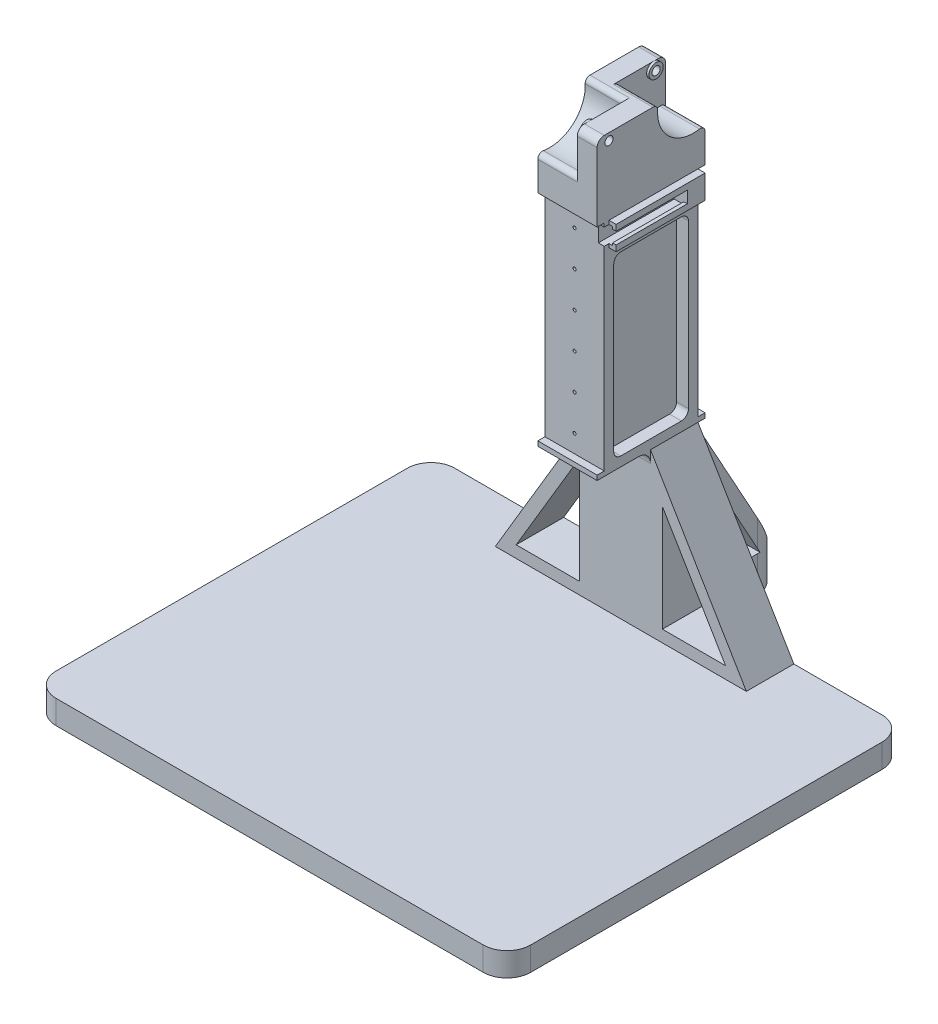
SolidWorks part; units mm, degrees
ref_plane "Front" through (0, 0, 0) normal (0, 0, 1) x (1, 0, 0)
ref_plane "Top" through (0, 0, 0) normal (0, 1, 0) x (1, 0, 0)
ref_plane "Right" through (0, 0, 0) normal (1, 0, 0) x (0, 0, -1)
sketch "Sketch1" plane through (0, 0, 0) normal (1, 0, 0) x (0, 0, -1)
  line L0 (0, 0) -> (0, -10)
  line L1 (0, -10) -> (67.49, -10)
  line L2 (67.49, -10) -> (67.49, 160.5)
  line L3 (67.49, 160.5) -> (27.987, 160.5)
  line L4 (27.987, 160.5) -> (27.987, 70)
  line L5 (27.987, 70) -> (47.49, 70)
  line L6 (47.49, 70) -> (47.49, 0)
  line L7 (47.49, 0) -> (0, 0)
  line L8 (50, 0) -> (-50, 0) construction
  line L9 (0, 50) -> (0, -50) construction
  dimension "D1" = 10
  dimension "D3" = 27.987
  dimension "D4" = 70
  dimension "D5" = 90.5
  dimension "D6" = 67.49
  dimension "D7" = 20
extrude "Boss-Extrude1" add sketch "Sketch1" along normal mid plane 25
hole_wizard "#55 (0.052) Diameter Hole1" positions "Sketch2" profile "Sketch3" hole size "#55" standard "ANSI Inch"
sketch "Sketch2" plane through (0, 0, -27.987) normal (0, 0, 1) x (1, 0, 0)
  line L0 (0, 77.5) -> (0, 92.5) construction
  line L1 (0, 92.5) -> (0, 107.5) construction
  line L2 (0, 107.5) -> (0, 122.5) construction
  line L4 (0, -50) -> (0, 50) construction
  line L5 (12.5, 70) -> (-12.5, 70) construction
  point P0 (0, 77.5)
  point P2 (0, 92.5)
  point P4 (0, 107.5)
  point P6 (0, 122.5)
  point P20 (0, 137.5)
  point P21 (0, 152.5)
  dimension "D1" = 15
  dimension "D2" = 7.5
  dimension "D3" = 15
  dimension "D4" = 15
sketch "Sketch3" plane through (0, 77.5, -27.987) normal (1, 0, 0) x (0, -1, 0)
  line L0 (0, 0) -> (0, 10.3968)
  line L1 (0, 10.3968) -> (0.6604, 10)
  line L2 (0.6604, 10) -> (0.6604, 0)
  line L5 (0.6604, 0) -> (0, 0)
  line L10 (0, 10.3968) -> (-0.6604, 10) construction
  line L11 (0, -6.35) -> (0, 107.95) construction
  dimension "Hole Dia." = 1.3208
  dimension "Hole Depth" = 10
  dimension "Drill Angle" = 118
sketch "Sketch4" plane through (0, 0, 0) normal (0, 1, 0) x (1, 0, 0)
  line L1 (-90, 67.4905) -> (90, 67.4905)
  line L2 (-100, 57.4905) -> (-100, -90.5095)
  line L3 (-90, -100.5095) -> (90, -100.5095)
  line L4 (100, 57.4905) -> (100, -90.5095)
  line L5 (0, 0) -> (0, 131.3458) construction
  arc A0 (-100, -90.5095) -> (-90, -100.5095) centre (-90, -90.5095) ccw
  arc A1 (90, -100.5095) -> (100, -90.5095) centre (90, -90.5095) ccw
  arc A2 (90, 67.4905) -> (100, 57.4905) centre (90, 57.4905) cw
  arc A3 (-90, 67.4905) -> (-100, 57.4905) centre (-90, 57.4905) ccw
  point P0 (0, 67.4905)
  point P11 (100, -100.5095)
  point P14 (100, 67.4905)
  point P17 (-100, 67.4905)
  dimension "D1" = 200
  dimension "D4" = 10
  dimension "D2" = 168
extrude "Boss-Extrude4" add sketch "Sketch4" against normal up to surface (10 mm away)
sketch "Sketch5" plane through (0, 70, 0) normal (0, -1, 0) x (1, 0, 0)
  line L0 (0, -50) -> (0, 50) construction
  line L1 (-12.5, -47.49) -> (12.5, -47.49)
  line L2 (-12.5, -47.49) -> (-12.5, -24.987)
  line L3 (-12.5, -24.987) -> (12.5, -24.987)
  line L4 (12.5, -47.49) -> (12.5, -24.987)
  line L5 (-12.5, -47.49) -> (12.5, -24.987) construction
  line L6 (-12.5, -24.987) -> (12.5, -47.49) construction
  line L7 (12.5, -27.987) -> (12.5, -47.49) construction
  line L8 (12.5, -47.49) -> (-12.5, -47.49) construction
  line L9 (12.5, -27.987) -> (-12.5, -27.987) construction
  point P0 (0, -36.2385)
  dimension "D1" = 3
extrude "Boss-Extrude5" add sketch "Sketch5" along normal blind 2
sketch "Sketch6" plane through (0, 160.5, 0) normal (0, 1, 0) x (1, 0, 0)
  line L0 (12.5, 67.49) -> (-12.5, 67.49) construction
  line L4 (12.5, 47.49) -> (-12.5, 47.49)
  line L5 (12.5, 24.987) -> (12.5, 47.49)
  line L6 (-12.5, 24.987) -> (12.5, 24.987)
  line L7 (-12.5, 47.49) -> (-12.5, 24.987)
  line L8 (12.5, 67.49) -> (-12.5, 67.49)
  line L9 (12.5, 24.987) -> (12.5, 67.49)
  line L10 (-12.5, 24.987) -> (12.5, 24.987)
  line L11 (-12.5, 67.49) -> (-12.5, 24.987)
  dimension "D1" = 0
extrude "Boss-Extrude6" add sketch "Sketch6" along normal blind 2
fillet "Fillet1" radius 5 1 edges at (0, 68, -47.49)
sketch "Sketch7" plane through (12.5, 0, 0) normal (1, 0, 0) x (0, 0, -1)
  line L0 (67.49, 0) -> (67.49, 162.5) construction
  line L1 (27.987, 160.5) -> (67.49, 160.5)
  line L2 (27.987, 160.5) -> (27.987, 150.5)
  line L3 (27.987, 150.5) -> (67.49, 150.5)
  line L4 (67.49, 160.5) -> (67.49, 150.5)
  line L5 (27.987, 160.5) -> (27.987, 70) construction
  line L6 (24.987, 162.5) -> (67.49, 162.5) construction
  dimension "D1" = 2
  dimension "D2" = 10
extrude "Boss-Extrude7" add sketch "Sketch7" along normal blind 3
sketch "Sketch8" plane through (0, 0, -27.987) normal (0, 0, 1) x (1, 0, 0)
  line L0 (15.5, 158) -> (14, 158)
  line L1 (14, 158) -> (14, 159)
  line L5 (14, 152) -> (14, 153)
  line L6 (14, 153) -> (15.5, 153)
  line L7 (15.5, 153) -> (15.5, 158)
  line L8 (12.5, 155.5) -> (15.5, 155.5) construction
  line L9 (15.5, 160.5) -> (15.5, 150.5) construction
  line L12 (14, 158) -> (14, 153) construction
  line L13 (14, 159) -> (10, 159)
  line L14 (10, 159) -> (10, 152)
  line L15 (10, 152) -> (14, 152)
  point P14 (15.5, 155.5)
  dimension "D1" = 1.5
  dimension "D2" = 4
  dimension "D3" = 5
sketch "Sketch9" plane through (0, 0, -67.49) normal (0, 0, -1) x (-1, 0, 0)
  line L0 (12.5, 0) -> (12.5, 162.5) construction
  line L1 (-12.5, 162.5) -> (12.5, 162.5)
  line L2 (-12.5, 162.5) -> (-12.5, 160.5)
  line L3 (-12.5, 160.5) -> (12.5, 160.5)
  line L4 (12.5, 162.5) -> (12.5, 160.5)
  line L5 (-15.5, 160.5) -> (-12.5, 160.5) construction
extrude "Boss-Extrude8" add sketch "Sketch9" along normal blind 3
sketch "Sketch10" plane through (0, 0, -67.49) normal (0, 0, -1) x (-1, 0, 0)
  line L0 (-12.5, 0) -> (-12.5, 150.5) construction
  line L1 (-12.5, 70) -> (12.5, 70)
  line L2 (-12.5, 70) -> (-12.5, 68)
  line L3 (-12.5, 68) -> (12.5, 68)
  line L4 (12.5, 70) -> (12.5, 68)
  line L5 (12.5, 0) -> (12.5, 160.5) construction
  line L7 (-12.5, 160.5) -> (12.5, 160.5) construction
  dimension "D1" = 2
  dimension "D2" = 90.5
extrude "Boss-Extrude9" add sketch "Sketch10" along normal blind 3
sketch "Sketch11" plane through (0, 0, -67.49) normal (0, 0, -1) x (-1, 0, 0)
  line L0 (12.5, 70) -> (-12.5, 70) construction
  point P0 (0, 77.5)
  point P1 (0, 92.5)
  point P2 (0, 107.5)
  point P3 (0, 122.5)
  point P4 (0, 137.5)
  point P5 (0, 152.5)
  dimension "D1" = 7.5
  dimension "D2" = 15
  dimension "D3" = 15
  dimension "D4" = 15
  dimension "D5" = 15
  dimension "D6" = 15
hole_wizard "#55 (0.052) Diameter Hole2" positions "Sketch12" profile "Sketch13" hole size "#55" standard "ANSI Inch"
sketch "Sketch12" plane through (0, 0, -67.49) normal (0, 0, -1) x (-1, 0, 0)
  point P0 (0, 77.5)
  point P3 (0, 92.5)
  point P6 (0, 107.5)
  point P9 (0, 122.5)
  point P12 (0, 137.5)
  point P15 (0, 152.5)
sketch "Sketch13" plane through (0, 77.5, -67.49) normal (1, 0, 0) x (0, 1, 0)
  line L0 (0, 0) -> (0, 10.3968)
  line L1 (0, 10.3968) -> (0.6604, 10)
  line L2 (0.6604, 10) -> (0.6604, 0)
  line L5 (0.6604, 0) -> (0, 0)
  line L10 (0, 10.3968) -> (-0.6604, 10) construction
  line L11 (0, -6.35) -> (0, 107.95) construction
  dimension "Hole Dia." = 1.3208
  dimension "Hole Depth" = 10
  dimension "Drill Angle" = 118
sketch "Sketch19" plane through (0, 0, -67.49) normal (0, 0, -1) x (-1, 0, 0)
  line L0 (-12.5, 68) -> (-52.9003, 0)
  line L1 (-52.9003, 0) -> (-12.5, 0)
  line L2 (-12.5, 0) -> (12.5, 0) construction
  line L3 (-12.5, 0) -> (-12.5, 68)
  line L4 (0, 68) -> (0, 0) construction
  line L5 (52.9003, 0) -> (12.5, 0)
  line L6 (12.5, 68) -> (52.9003, 0)
  line L7 (12.5, 0) -> (12.5, 68)
extrude "Extrude-Thin1" add sketch "Sketch19" against normal blind 20 thin
sketch "Sketch20" plane through (0, 0, -67.49) normal (0, 0, -1) x (-1, 0, 0)
  line L0 (-12.5, 68) -> (12.5, 68) construction
  line L1 (-10, 68) -> (10, 68)
  line L2 (-10, 68) -> (-10, 0)
  line L4 (10, 68) -> (10, 0)
  line L6 (-10, 0) -> (10, 0)
  line L7 (-52.9003, 0) -> (52.9003, 0) construction
  dimension "D1" = 20
  dimension "D2" = 2.5
extrude "Boss-Extrude11" add sketch "Sketch20" along normal blind 43
sketch "Sketch22" plane through (10, 0, 0) normal (1, 0, 0) x (0, 0, -1)
  line L1 (67.49, 68) -> (104.9772, 0)
  line L4 (104.9772, 68) -> (67.49, 68)
  line L6 (110.49, 0) -> (67.4905, 0) construction
  line L7 (104.9772, 68) -> (110.49, 68)
  line L8 (110.49, 68) -> (110.49, 0) construction
  line L9 (110.49, 68) -> (70.49, 68) construction
  line L10 (110.49, 68) -> (110.49, 0)
  line L11 (110.49, 0) -> (104.9772, 0)
extrude "Cut-Extrude4" cut sketch "Sketch22" against normal blind 43
sketch "Sketch24" plane through (10, 0, 0) normal (1, 0, 0) x (0, 0, -1)
  line L0 (72.49, 47.9007) -> (72.49, 0)
  line L2 (98.8968, 0) -> (72.49, 47.9007)
  line L3 (67.49, 68) -> (104.9772, 0) construction
  line L4 (67.49, 68) -> (67.49, 0) construction
  line L6 (72.49, 0) -> (98.8968, 0)
  line L7 (104.9772, 0) -> (67.4905, 0) construction
  dimension "D1" = 0
  dimension "D2" = 5
extrude "Cut-Extrude5" cut sketch "Sketch24" against normal blind 43
sketch "Sketch12" plane through (0, 0, -67.4905) normal (0, 0, -1) x (-1, 0, 0)
  line L0 (90, -10) -> (-90, -10) construction
  line L1 (-10, 0) -> (10, 0)
  line L2 (-10, 0) -> (-10, -10)
  line L3 (-10, -10) -> (10, -10)
  line L4 (10, 0) -> (10, -10)
  line L5 (10, 0) -> (10, 68) construction
extrude "Boss-Extrude13" add sketch "Sketch12" along normal blind 37.5
sketch "Sketch13" plane through (0, 0, -72.49) normal (0, 0, -1) x (-1, 0, 0)
  line L0 (10, 47.9007) -> (10, 0) construction
  line L1 (-10, 0) -> (10, 0)
  line L2 (-10, 0) -> (-10, 5)
  line L3 (-10, 5) -> (10, 5)
  line L4 (10, 0) -> (10, 5)
  line L5 (-44.1138, 5) -> (-17.5, 5) construction
extrude "Boss-Extrude14" add sketch "Sketch13" along normal up to next
fillet "Fillet4" radius 10 2 edges at (10, -5, -104.9905) (-10, -5, -104.9905)
sketch "Sketch28" plane through (0, 162.5, 0) normal (0, 1, 0) x (1, 0, 0)
  line L0 (12.5, 24.987) -> (12.5, 70.49) construction
  line L2 (12.5, 27.987) -> (12.5, 67.49)
  line L4 (-12.5, 27.987) -> (-12.5, 67.49)
  line L5 (15.5, 27.987) -> (12.5, 27.987) construction
  line L6 (-52.9003, 67.49) -> (-12.5, 67.49) construction
  line L7 (-12.5, 70.49) -> (-12.5, 24.987) construction
  line L8 (-12.5, 24.987) -> (12.5, 24.987)
  line L9 (12.5, 24.987) -> (12.5, 27.987)
  line L10 (-12.5, 24.987) -> (-12.5, 27.987)
  line L11 (-12.5, 67.49) -> (-12.5, 70.49)
  line L12 (-12.5, 70.49) -> (12.5, 70.49)
  line L13 (12.5, 70.49) -> (12.5, 67.49)
extrude "Boss-Extrude15" add sketch "Sketch28" along normal blind 30
sketch "Sketch36" plane through (12.5, 0, 0) normal (1, 0, 0) x (0, 0, -1)
  line L0 (24.987, 192.5) -> (70.49, 192.5) construction
  line L1 (70.49, 192.5) -> (70.49, 160.5) construction
  circle A0 centre (65.49, 189.5) radius 15
  dimension "D1" = 30
  dimension "D2" = 3
  dimension "D3" = 5
extrude "Cut-Extrude8" cut sketch "Sketch36" against normal blind 16.65
sketch "Sketch37" plane through (-12.5, 0, 0) normal (-1, 0, 0) x (0, 0, 1)
  line L0 (-24.987, 192.5) -> (-24.987, 160.5) construction
  line L1 (-70.49, 192.5) -> (-24.987, 192.5) construction
  circle A0 centre (-29.987, 189.5) radius 15
  dimension "D1" = 30
  dimension "D2" = 5
  dimension "D3" = 3
extrude "Cut-Extrude9" cut sketch "Sketch37" against normal blind 16.65
sketch "Sketch38" plane through (4.15, 0, 0) normal (-1, 0, 0) x (0, 0, 1)
  line L1 (-44.6839, 192.5) -> (-24.987, 192.5) construction
  line L2 (-24.987, 175.3579) -> (-24.987, 192.5) construction
  point P0 (-29.987, 189.5)
  dimension "D1" = 5
  dimension "D2" = 3
hole_wizard "#8-36 Tapped Hole1" positions "Sketch39" profile "Sketch40" tap size "#8-36" standard "ANSI Inch"
sketch "Sketch39" plane through (4.15, 0, 0) normal (-1, 0, 0) x (0, 0, 1)
  point P0 (-29.987, 189.5)
sketch "Sketch40" plane through (4.15, 189.5, -29.987) normal (0, 1, 0) x (0, 0, 1)
  line L0 (0, 0) -> (0, 8.35)
  line L1 (0, 8.35) -> (1.7272, 8.35)
  line L2 (1.7272, 8.35) -> (1.7272, 0)
  line L5 (1.7272, 0) -> (0, 0)
  line L11 (0, -6.35) -> (0, 107.95) construction
  dimension "Thru Tap Drill Dia." = 3.4544
  dimension "Thru Tap Drill Depth" = 8.35
sketch "Sketch41" plane through (-4.15, 0, 0) normal (1, 0, 0) x (0, 0, -1)
  line L0 (50.7931, 192.5) -> (70.49, 192.5) construction
  line L2 (70.49, 192.5) -> (70.49, 175.3579) construction
  point P0 (65.49, 189.5)
  dimension "D1" = 3
  dimension "D2" = 5
hole_wizard "#8-32 Tapped Hole1" positions "Sketch44" profile "Sketch43" tap size "#8-32" standard "ANSI Inch"
sketch "Sketch44" plane through (-4.15, 0, 0) normal (1, 0, 0) x (0, 0, -1)
  point P0 (65.49, 189.5)
sketch "Sketch43" plane through (-4.15, 189.5, -65.49) normal (0, 1, 0) x (0, 0, -1)
  line L0 (0, 0) -> (0, 8.35)
  line L1 (0, 8.35) -> (1.7272, 8.35)
  line L2 (1.7272, 8.35) -> (1.7272, 0)
  line L5 (1.7272, 0) -> (0, 0)
  line L11 (0, -6.35) -> (0, 107.95) construction
  dimension "Thru Tap Drill Dia." = 3.4544
  dimension "Thru Tap Drill Depth" = 8.35
fillet "Fillet6" radius 3 2 edges at (-8.325, 192.5, -70.49) (8.325, 192.5, -24.987)
extrude "Cut-Extrude10" cut sketch "Sketch8" against normal blind 32
sketch "Sketch45" plane through (0, 160.5, 0) normal (0, 1, 0) x (1, 0, 0)
  line L0 (15.5, 67.49) -> (15.5, 27.987) construction
  line L1 (12.5, 27.987) -> (15.5, 27.987)
  line L2 (12.5, 27.987) -> (12.5, 29.987)
  line L3 (12.5, 29.987) -> (15.5, 29.987)
  line L4 (15.5, 27.987) -> (15.5, 29.987)
  dimension "D1" = 2
extrude "Cut-Extrude11" cut sketch "Sketch45" against normal up to surface (10 mm away)
sketch "Sketch46" plane through (-4.15, 0, 0) normal (1, 0, 0) x (0, 0, -1)
  circle A0 centre (65.49, 189.5) radius 3
  circle A1 centre (65.49, 189.5) radius 1.7272
  dimension "D1" = 6
fillet "Fillet10" radius 2 4 edges at (-4.175, 192.5, -44.6839) (-4.175, 175.3579, -24.987) (4.175, 192.5, -50.7931) (4.175, 175.3579, -70.49)
sketch "Sketch47" plane through (4.15, 0, 0) normal (-1, 0, 0) x (0, 0, 1)
  circle A0 centre (-29.987, 189.5) radius 3
  circle A1 centre (-29.987, 189.5) radius 1.7272
  dimension "D1" = 6
extrude "Boss-Extrude18" add sketch "Sketch47" along normal blind 1
sketch "Sketch48" plane through (-4.15, 0, 0) normal (1, 0, 0) x (0, 0, -1)
  circle A0 centre (65.49, 189.5) radius 1.7272
  circle A1 centre (65.49, 189.5) radius 2.38
  dimension "D1" = 4.76
extrude "Boss-Extrude19" add sketch "Sketch48" along normal blind 1
extrude "Boss-Extrude17" add sketch "Sketch46" along normal blind 1
sketch "Sketch49" plane through (12.5, 0, 0) normal (1, 0, 0) x (0, 0, -1)
  line L0 (29.987, 150.5) -> (67.49, 150.5) construction
  line L1 (31.987, 146.5) -> (63.49, 146.5)
  line L2 (31.987, 146.5) -> (31.987, 72)
  line L3 (31.987, 72) -> (63.49, 72)
  line L4 (63.49, 146.5) -> (63.49, 72)
  line L5 (47.49, 68) -> (67.49, 68) construction
  line L6 (67.49, 70) -> (67.49, 150.5) construction
  line L7 (27.987, 152) -> (27.987, 70) construction
  dimension "D1" = 4
  dimension "D2" = 4
  dimension "D3" = 4
  dimension "D4" = 4
extrude "Cut-Extrude12" cut sketch "Sketch49" against normal blind 5
mirror "Mirror1" about plane through (0, 0, 0) normal (1, 0, 0) of "Cut-Extrude12"
fillet "Fillet11" radius 3 8 edges at (-10, 146.5, -31.987) (-10, 146.5, -63.49) (-10, 72, -31.987) (-10, 72, -63.49) (10, 72, -31.987) (10, 72, -63.49) (10, 146.5, -63.49) (10, 146.5, -31.987)
